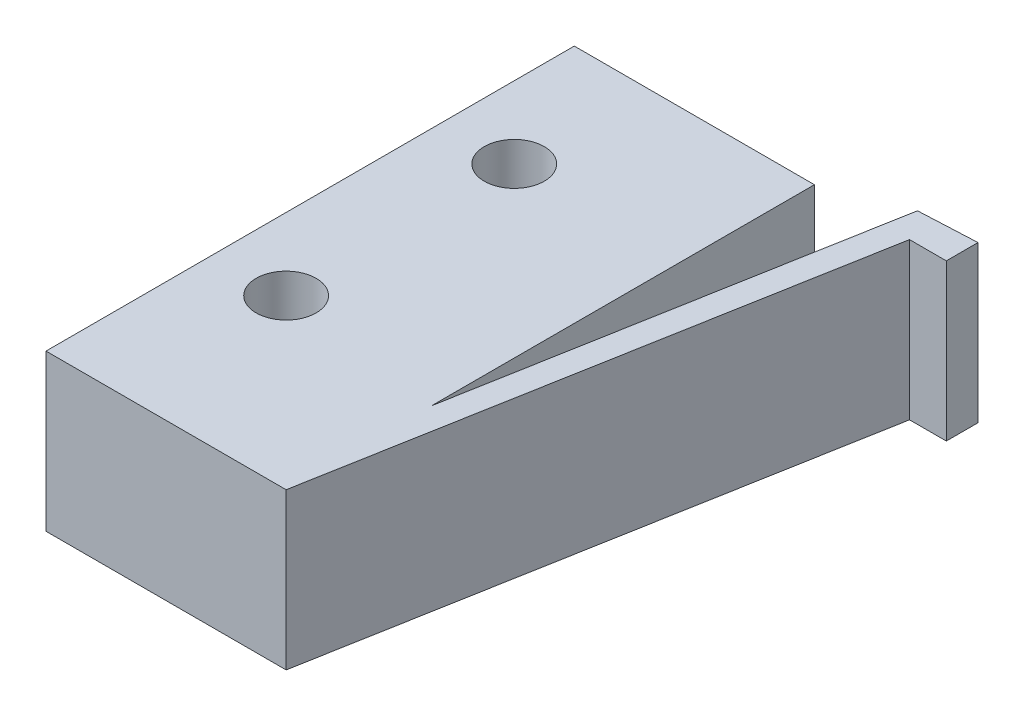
SolidWorks part; units mm, degrees
ref_plane "Front Plane" through (0, 0, 0) normal (0, 0, 1) x (1, 0, 0)
ref_plane "Top Plane" through (0, 0, 0) normal (0, 1, 0) x (1, 0, 0)
ref_plane "Right Plane" through (0, 0, 0) normal (1, 0, 0) x (0, 0, -1)
sketch "Sketch1" plane through (0, 0, 0) normal (0, 1, 0) x (1, 0, 0)
  line L1 (-5, -11) -> (5, -11)
  line L2 (-5, -11) -> (-5, 11)
  line L3 (-5, 11) -> (5, 11)
  line L4 (5, -11) -> (5, 11)
  line L5 (-5, -11) -> (5, 11) construction
  line L6 (-5, 11) -> (5, -11) construction
  circle A0 centre (-2, 5.5) radius 1.25
  circle A1 centre (-2, -4) radius 1.25
  point P0 (0, 0)
  dimension "D3" = 9.5
  dimension "D1" = 10
  dimension "D2" = 22
  dimension "D4" = 5.5
  dimension "D5" = 3
extrude "Boss-Extrude1" add sketch "Sketch1" along normal mid plane 6.5
sketch "Sketch3" plane through (0, 3.25, 0) normal (0, 1, 0) x (1, 0, 0)
  line L0 (5, -11) -> (8.9598, 11)
  line L1 (8.9598, 11) -> (10.4918, 11)
  line L2 (10.4918, 11) -> (10.4918, 12.3196)
  line L3 (10.4918, 12.3196) -> (8.0868, 12.2043)
  line L4 (8.0868, 12.2043) -> (4.9136, -5.4251)
  line L5 (4.9136, -5.4251) -> (5, -11)
extrude "Boss-Extrude2" add sketch "Sketch3" against normal up to surface (6.5 mm away)
